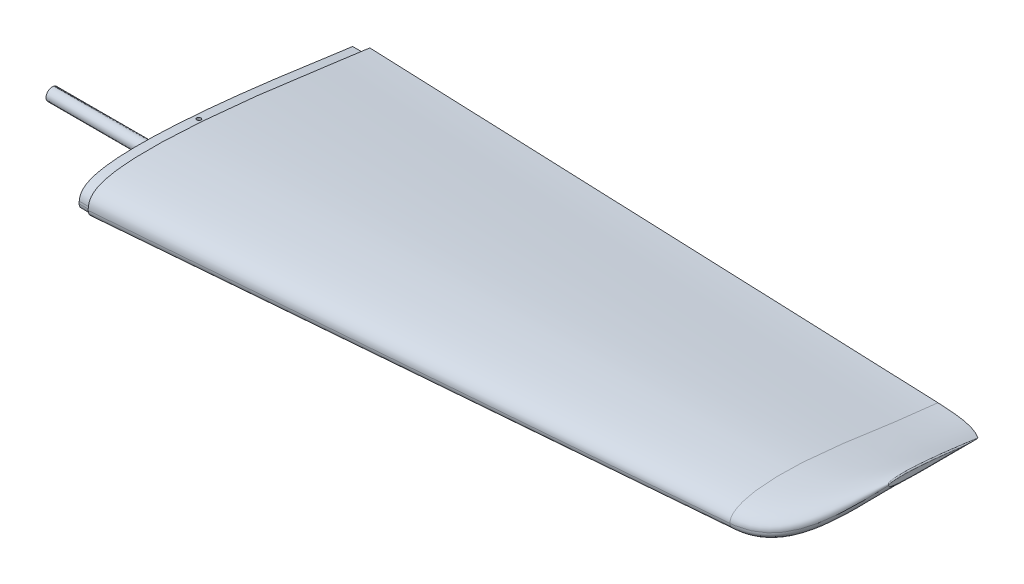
SolidWorks part; units mm, degrees
ref_plane "Front Plane" through (0, 0, 0) normal (0, 0, 1) x (1, 0, 0)
ref_plane "Top Plane" through (0, 0, 0) normal (0, 1, 0) x (1, 0, 0)
ref_plane "Right Plane" through (0, 0, 0) normal (1, 0, 0) x (0, 0, -1)
sketch "Sketch1" plane through (0, 0, 0) normal (1, 0, 0) x (0, 0, -1)
  spline S0 degree 5 poles (2952.4377, 714.2145) (-3950.7893, -404.0185) (5403.0351, 63.7514) (-5791.8485, 254.0841) (4132.9966, -89.5548) (-3213.7891, -212.6999) knots -1.284262 -1.284262 -1.284262 -1.284262 -1.284262 -1.284262 2.101509 2.101509 2.101509 2.101509 2.101509 2.101509 only from (41.3116, 20) to (-230.462, 22.2132) construction
  spline S2 degree 5 poles (41.3116, 20) (-5.4057, 25.19) (-86.087, 40.9859) (-202.7415, 49.6835) (-228.6633, 43.27) (-230.462, 22.2132) knots 0 0 0 0 0 0 0.979969 0.979969 0.979969 0.979969 0.979969 0.979969
  spline S3 degree 5 poles (-3149.1163, 653.2935) (4472.5292, -309.3143) (-6676.5573, 85.3178) (6680.972, 70.2042) (-4911.318, -187.2823) (2983.3997, 534.4321) knots -1.198996 -1.198996 -1.198996 -1.198996 -1.198996 -1.198996 2.46145 2.46145 2.46145 2.46145 2.46145 2.46145 only from (-230.5509, 20) to (41.3116, 20) construction
  spline S4 degree 5 poles (2696.3783, 672.1362) (-3670.2914, -389.7404) (5148.682, 68.0628) (-5640.6553, 248.8183) (4077.0527, -90.5219) (-3214.3233, -212.7089) knots -1.258218 -1.258218 -1.258218 -1.258218 -1.258218 -1.258218 2.101558 2.101558 2.101558 2.101558 2.101558 2.101558 only from (-230.462, 22.2132) to (-230.5509, 20) construction
  spline S5 degree 5 poles (-230.5509, 20) (-230.5509, 3.5988) (-195.743, 3.0631) (-74.1311, 6.2775) (10.2472, 10.2955) (41.3116, 20) knots 0 0 0 0 0 0 1 1 1 1 1 1
  spline S6 degree 5 poles (-230.462, 22.2132) (-230.4988, 21.7828) (-230.5255, 21.3462) (-230.5426, 20.9036) (-230.5509, 20.4549) (-230.5509, 20) knots 0.979969 0.979969 0.979969 0.979969 0.979969 0.979969 1 1 1 1 1 1
ref_plane "Plane1" through (570, 0, 0) normal (1, 0, 0) x (0, 0, -1)
sketch "Sketch2" plane through (570, 0, 0) normal (1, 0, 0) x (0, 0, -1)
  line L0 (-181.1092, 18.7085) -> (-181.1092, 38.9448) construction
  line L1 (-181.1092, 38.9448) -> (-123.2805, 43.5905) construction
  line L2 (-123.2805, 43.5905) -> (-54.3198, 27.7563) construction
  line L3 (-54.3198, 27.7563) -> (-15.1798, 21.927) construction
  line L4 (-15.1798, 21.927) -> (19.7964, 19.0955) construction
  line L5 (-181.1092, 18.7085) -> (-181.1092, -2.2997) construction
  line L6 (-181.1092, -2.2997) -> (-109.1149, 13.356) construction
  line L7 (-109.1149, 13.356) -> (-44.4931, 11.9338) construction
  line L8 (-44.4931, 11.9338) -> (-14.1805, 14.4321) construction
  line L9 (-14.1805, 14.4321) -> (19.7964, 19.0955) construction
  spline_without_curve S0
  spline_without_curve S1
  dimension "D1" = 19.7964
  dimension "D2" = 14.1805
  dimension "D3" = 15.1798
  dimension "D4" = 44.4931
  dimension "D5" = 54.3198
  dimension "D6" = 109.1149
  dimension "D7" = 123.2805
  dimension "D8" = 181.1092
  dimension "D9" = 11.9338
  dimension "D10" = 13.356
  dimension "D11" = 14.4321
  dimension "D12" = 18.7085
  dimension "D13" = 19.0955
  dimension "D14" = 21.927
  dimension "D15" = 27.7563
  dimension "D16" = 38.9448
  dimension "D17" = 43.5905
  dimension "D18" = 2.2997
loft "Loft1" add profiles "Sketch1", "Sketch2"
sketch "Sketch3" plane through (570, 0, 0) normal (1, 0, 0) x (0, 0, -1)
  spline S2 degree 5 poles (1358.2702, 1294.7476) (-1454.972, -1242.9893) (176.522, 1147.2012) (676.699, -975.6765) (-1197.9925, 836.9635) (1926.9197, -556.4867) knots -0.951211 -0.951211 -0.951211 -0.951211 -0.951211 -0.951211 2.263642 2.263642 2.263642 2.263642 2.263642 2.263642 only from (-181.1092, 18.7085) to (19.7964, 19.0955)
  spline S3 degree 5 poles (-181.1092, 18.7085) (-181.1092, -2.2997) (-109.1149, 13.356) (-44.4931, 11.9338) (-14.1805, 14.4321) (19.7964, 19.0955) knots 0 0 0 0 0 0 1 1 1 1 1 1
  spline S4 degree 5 poles (1817.3748, -850.8395) (-1728.2101, 1182.0414) (1798.3394, -1432.1315) (-1265.8092, 1574.5215) (-647.0871, -1188.1411) (1701.7582, 523.8863) knots -1.280148 -1.280148 -1.280148 -1.280148 -1.280148 -1.280148 2.307232 2.307232 2.307232 2.307232 2.307232 2.307232 only from (19.7964, 19.0955) to (-181.1092, 18.7085)
  spline S5 degree 5 poles (19.7964, 19.0955) (-15.1798, 21.927) (-54.3198, 27.7563) (-123.2805, 43.5905) (-181.1092, 38.9448) (-181.1092, 18.7085) knots 0 0 0 0 0 0 1 1 1 1 1 1
  dimension "D1" = 0
ref_plane "Plane2" through (634, 0, 0) normal (1, 0, 0) x (0, 0, -1)
sketch "Sketch4" plane through (634, 0, 0) normal (1, 0, 0) x (0, 0, -1)
  line L0 (-92.0168, 37.6148) -> (-92.0168, 42.6148) construction
  line L1 (-92.0168, 42.6148) -> (-57.0806, 41.5276) construction
  line L2 (-57.0806, 41.5276) -> (-5.2819, 33.7019) construction
  line L3 (-92.0168, 37.6148) -> (-92.0168, 32.6148) construction
  line L4 (-92.0168, 32.6148) -> (-57.267, 34.0746) construction
  line L5 (-57.267, 34.0746) -> (-5.2819, 33.7019) construction
  spline S0 degree 3 poles (-92.0168, 37.6148) (-92.0168, 42.6148) (-57.0806, 41.5276) (-5.2819, 33.7019) knots 0 0 0 0 1 1 1 1
  spline S1 degree 3 poles (-92.0168, 37.6148) (-92.0168, 32.6148) (-57.267, 34.0746) (-5.2819, 33.7019) knots 0 0 0 0 1 1 1 1
  dimension "D1" = 5
  dimension "D2" = 5.2819
  dimension "D3" = 57.0806
  dimension "D4" = 57.267
  dimension "D5" = 92.0168
  dimension "D6" = 32.6148
  dimension "D7" = 33.7019
  dimension "D8" = 34.0746
  dimension "D10" = 41.5276
loft "Loft2" add profiles "Sketch3", "Sketch4"
sketch "Sketch5" plane through (0, 0, 0) normal (-1, 0, 0) x (0, 0, 1)
  line L0 (113.4285, 11.4777) -> (113.4285, 7.8638) construction
  line L1 (123.9285, 11.4777) -> (113.4285, 11.4777) construction
  line L2 (123.9285, 7.6059) -> (123.9285, 11.4777) construction
  line L3 (113.4285, 11.4777) -> (113.4285, 7.8638)
  line L4 (123.9285, 11.4777) -> (113.4285, 11.4777)
  line L5 (123.9285, 7.6059) -> (123.9285, 11.4777)
  spline S2 degree 3 poles (-98.0213, 3009.8518) (-234.8212, 134.1255) (-133.9669, 36.7131) (-23.6242, 17.3831) (-20.8516, 16.9523) (-15.3007, 16.1593) (-12.5223, 15.7977) (-6.9612, 15.1235) (-4.1785, 14.8112) (4.1742, 13.9295) (9.7489, 13.4148) (20.9063, 12.478) (26.489, 12.0567) (43.2458, 10.8941) (54.4284, 10.2517) (76.8086, 9.1439) (88.0077, 8.68) (110.4146, 7.9195) (121.6195, 7.6223) (138.4299, 7.3398) (144.0338, 7.2733) (155.2431, 7.2134) (160.849, 7.2195) (172.0593, 7.3383) (177.6634, 7.4496) (186.067, 7.7504) (188.8672, 7.8734) (194.4638, 8.1832) (197.2607, 8.3697) (202.8472, 8.8399) (205.6354, 9.1222) (209.8045, 9.6697) (211.1918, 9.8732) (213.955, 10.3394) (215.3321, 10.6019) (218.0679, 11.2167) (219.4235, 11.5672) (221.4251, 12.2059) (222.0885, 12.4387) (223.3906, 12.9552) (224.0289, 13.2384) (225.2674, 13.8788) (225.8682, 14.2352) (227.0069, 15.0704) (227.531, 15.5393) (228.1987, 16.3618) (228.3988, 16.6543) (228.7373, 17.2634) (228.8775, 17.5822) (229.0982, 18.249) (229.178, 18.5974) (233.5383, 48.7828) (32.2779, 103.3898) (3215.602, -249.8222) knots -1.183286 -1.183286 -1.183286 -1.183286 0.03125 0.03125 0.0625 0.0625 0.09375 0.09375 0.125 0.125 0.1875 0.1875 0.25 0.25 0.375 0.375 0.5 0.5 0.625 0.625 0.6875 0.6875 0.75 0.75 0.8125 0.8125 0.84375 0.84375 0.875 0.875 0.90625 0.90625 0.921875 0.921875 0.9375 0.9375 0.953125 0.953125 0.960938 0.960938 0.96875 0.96875 0.976562 0.976562 0.984375 0.984375 0.988281 0.988281 0.992188 0.992188 0.996094 0.996094 1.330737 1.330737 1.330737 1.330737 only from (-34.6785, 19.5247) to (229.3009, 20)
  spline S3 degree 3 poles (-34.6785, 19.5247) (-31.9234, 18.8898) (-29.16, 18.3529) (-23.6242, 17.3831) (-20.8516, 16.9523) (-15.3007, 16.1593) (-12.5223, 15.7977) (-6.9612, 15.1235) (-4.1785, 14.8112) (4.1742, 13.9295) (9.7489, 13.4148) (20.9063, 12.478) (26.489, 12.0567) (43.2458, 10.8941) (54.4284, 10.2517) (76.8086, 9.1439) (88.0077, 8.68) (110.4146, 7.9195) (121.6195, 7.6223) (138.4299, 7.3398) (144.0338, 7.2733) (155.2431, 7.2134) (160.849, 7.2195) (172.0593, 7.3383) (177.6634, 7.4496) (186.067, 7.7504) (188.8672, 7.8734) (194.4638, 8.1832) (197.2607, 8.3697) (202.8472, 8.8399) (205.6354, 9.1222) (209.8045, 9.6697) (211.1918, 9.8732) (213.955, 10.3394) (215.3321, 10.6019) (218.0679, 11.2167) (219.4235, 11.5672) (221.4251, 12.2059) (222.0885, 12.4387) (223.3906, 12.9552) (224.0289, 13.2384) (225.2674, 13.8788) (225.8682, 14.2352) (227.0069, 15.0704) (227.531, 15.5393) (228.1987, 16.3618) (228.3988, 16.6543) (228.7373, 17.2634) (228.8775, 17.5822) (229.0982, 18.249) (229.178, 18.5974) (229.2786, 19.294) (229.3009, 19.6457) (229.3009, 20) knots 0 0 0 0 0.03125 0.03125 0.0625 0.0625 0.09375 0.09375 0.125 0.125 0.1875 0.1875 0.25 0.25 0.375 0.375 0.5 0.5 0.625 0.625 0.6875 0.6875 0.75 0.75 0.8125 0.8125 0.84375 0.84375 0.875 0.875 0.90625 0.90625 0.921875 0.921875 0.9375 0.9375 0.953125 0.953125 0.960938 0.960938 0.96875 0.96875 0.976562 0.976562 0.984375 0.984375 0.988281 0.988281 0.992188 0.992188 0.996094 0.996094 1 1 1 1
  spline S4 degree 3 poles (3156.1783, 672.5534) (-2720.9418, -772.2381) (3187.5295, 754.4568) (-2723.4332, -495.7356) knots -67.068437 -67.068437 -67.068437 -67.068437 62.712782 62.712782 62.712782 62.712782 only from (229.3009, 20) to (229.2165, 22.1068)
  spline S5 degree 3 poles (229.3009, 20) (229.3009, 20.7031) (229.2764, 21.4062) (229.2165, 22.1068) knots 0 0 0 0 1 1 1 1
  spline S7 degree 3 poles (3177.0592, 564.5344) (-12.755, -128.0518) (245.6017, -18.8185) (228.1741, 26.6537) (228.0284, 26.9888) (227.7108, 27.6364) (227.5382, 27.9507) (226.9799, 28.866) (226.5536, 29.4391) (225.8387, 30.2472) (225.587, 30.5089) (225.0642, 31.0119) (224.7948, 31.2518) (223.9653, 31.9412) (223.3844, 32.3606) (222.179, 33.137) (221.5546, 33.4939) (220.2711, 34.1579) (219.6178, 34.4619) (217.6422, 35.3046) (216.299, 35.7779) (213.5795, 36.6112) (212.2029, 36.9705) (209.4258, 37.6082) (208.0253, 37.8864) (205.2064, 38.3818) (203.7925, 38.5981) (199.5545, 39.173) (196.7276, 39.4602) (191.0714, 39.9116) (188.2422, 40.0749) (179.7524, 40.4322) (174.0894, 40.4963) (162.7597, 40.4182) (157.093, 40.2733) (145.7571, 39.8385) (140.0859, 39.5475) (123.084, 38.5099) (111.7698, 37.602) (89.1685, 35.5019) (77.8815, 34.307) (55.3281, 31.702) (44.0612, 30.2902) (27.1785, 28.0564) (21.5536, 27.2924) (10.3074, 25.7373) (4.6861, 24.9459) (-6.5553, 23.3558) (-12.1755, 22.5564) (-227.773, -7.4444) (-440.5038, -16.3117) (-1037.0862, 2809.5382) knots -0.505582 -0.505582 -0.505582 -0.505582 0.015625 0.015625 0.019531 0.019531 0.023437 0.023437 0.03125 0.03125 0.035156 0.035156 0.039062 0.039062 0.046875 0.046875 0.054687 0.054687 0.0625 0.0625 0.078125 0.078125 0.09375 0.09375 0.109375 0.109375 0.125 0.125 0.15625 0.15625 0.1875 0.1875 0.25 0.25 0.3125 0.3125 0.375 0.375 0.5 0.5 0.625 0.625 0.75 0.75 0.8125 0.8125 0.875 0.875 0.9375 0.9375 3.271617 3.271617 3.271617 3.271617 only from (229.2165, 22.1068) to (-34.6785, 19.5247)
  spline S8 degree 3 poles (229.2165, 22.1068) (229.0931, 23.5517) (228.8223, 24.9624) (228.1741, 26.6537) (228.0284, 26.9888) (227.7108, 27.6364) (227.5382, 27.9507) (226.9799, 28.866) (226.5536, 29.4391) (225.8387, 30.2472) (225.587, 30.5089) (225.0642, 31.0119) (224.7948, 31.2518) (223.9653, 31.9412) (223.3844, 32.3606) (222.179, 33.137) (221.5546, 33.4939) (220.2711, 34.1579) (219.6178, 34.4619) (217.6422, 35.3046) (216.299, 35.7779) (213.5795, 36.6112) (212.2029, 36.9705) (209.4258, 37.6082) (208.0253, 37.8864) (205.2064, 38.3818) (203.7925, 38.5981) (199.5545, 39.173) (196.7276, 39.4602) (191.0714, 39.9116) (188.2422, 40.0749) (179.7524, 40.4322) (174.0894, 40.4963) (162.7597, 40.4182) (157.093, 40.2733) (145.7571, 39.8385) (140.0859, 39.5475) (123.084, 38.5099) (111.7698, 37.602) (89.1685, 35.5019) (77.8815, 34.307) (55.3281, 31.702) (44.0612, 30.2902) (27.1785, 28.0564) (21.5536, 27.2924) (10.3074, 25.7373) (4.6861, 24.9459) (-6.5553, 23.3558) (-12.1755, 22.5564) (-23.4203, 20.9916) (-29.0448, 20.2238) (-34.6785, 19.5247) knots 0 0 0 0 0.015625 0.015625 0.019531 0.019531 0.023437 0.023437 0.03125 0.03125 0.035156 0.035156 0.039062 0.039062 0.046875 0.046875 0.054687 0.054687 0.0625 0.0625 0.078125 0.078125 0.09375 0.09375 0.109375 0.109375 0.125 0.125 0.15625 0.15625 0.1875 0.1875 0.25 0.25 0.3125 0.3125 0.375 0.375 0.5 0.5 0.625 0.625 0.75 0.75 0.8125 0.8125 0.875 0.875 0.9375 0.9375 1 1 1 1
  dimension "D1" = 1.25
extrude "Boss-Extrude1" add sketch "Sketch5" along normal blind 10
sketch "Sketch6" plane through (0, 0, 0) normal (0, 1, 0) x (1, 0, 0)
  circle A0 centre (-5, -118.6785) radius 2 construction
  circle A1 centre (-5, -118.6785) radius 2
extrude "Cut-Extrude1" cut sketch "Sketch6" against normal through all both and the other way through all
fillet "Fillet1" radius 1 2 edges
sketch "Sketch7" plane through (-10, 0, 0) normal (-1, 0, 0) x (0, 0, 1)
  line L3 (113.4285, 7.8638) -> (113.4285, 11.4777)
  line L4 (113.4285, 11.4777) -> (123.9285, 11.4777)
  line L5 (123.9285, 11.4777) -> (123.9285, 7.6059)
  line L6 (113.4285, 7.8638) -> (113.4285, 11.4777)
  line L7 (113.4285, 11.4777) -> (123.9285, 11.4777)
  line L8 (123.9285, 11.4777) -> (123.9285, 7.6059)
  circle A0 centre (155.4725, 24.9777) radius 7 construction
  circle A1 centre (155.4725, 24.9777) radius 7
  spline S4 degree 3 poles (3156.1783, 672.5534) (-2720.9418, -772.2381) (3187.5295, 754.4568) (-2723.4332, -495.7356) knots -67.068437 -67.068437 -67.068437 -67.068437 62.712782 62.712782 62.712782 62.712782 only from (229.3009, 20) to (229.2165, 22.1068)
  spline S5 degree 3 poles (3177.0592, 564.5344) (-12.755, -128.0518) (245.6017, -18.8185) (228.1741, 26.6537) (228.0284, 26.9888) (227.7108, 27.6364) (227.5382, 27.9507) (226.9799, 28.866) (226.5536, 29.4391) (225.8387, 30.2472) (225.587, 30.5089) (225.0642, 31.0119) (224.7948, 31.2518) (223.9653, 31.9412) (223.3844, 32.3606) (222.179, 33.137) (221.5546, 33.4939) (220.2711, 34.1579) (219.6178, 34.4619) (217.6422, 35.3046) (216.299, 35.7779) (213.5795, 36.6112) (212.2029, 36.9705) (209.4258, 37.6082) (208.0253, 37.8864) (205.2064, 38.3818) (203.7925, 38.5981) (199.5545, 39.173) (196.7276, 39.4602) (191.0714, 39.9116) (188.2422, 40.0749) (179.7524, 40.4322) (174.0894, 40.4963) (162.7597, 40.4182) (157.093, 40.2733) (145.7571, 39.8385) (140.0859, 39.5475) (123.084, 38.5099) (111.7698, 37.602) (89.1685, 35.5019) (77.8815, 34.307) (55.3281, 31.702) (44.0612, 30.2902) (27.1785, 28.0564) (21.5536, 27.2924) (10.3074, 25.7373) (4.6861, 24.9459) (-6.5553, 23.3558) (-12.1755, 22.5564) (-227.773, -7.4444) (-440.5038, -16.3117) (-1037.0862, 2809.5382) knots -0.505582 -0.505582 -0.505582 -0.505582 0.015625 0.015625 0.019531 0.019531 0.023437 0.023437 0.03125 0.03125 0.035156 0.035156 0.039062 0.039062 0.046875 0.046875 0.054687 0.054687 0.0625 0.0625 0.078125 0.078125 0.09375 0.09375 0.109375 0.109375 0.125 0.125 0.15625 0.15625 0.1875 0.1875 0.25 0.25 0.3125 0.3125 0.375 0.375 0.5 0.5 0.625 0.625 0.75 0.75 0.8125 0.8125 0.875 0.875 0.9375 0.9375 3.271617 3.271617 3.271617 3.271617 only from (229.2165, 22.1068) to (-34.6785, 19.5247)
  spline S6 degree 3 poles (-98.033, 3009.6053) (-234.8154, 134.1199) (-133.9638, 36.7126) (-23.6242, 17.3831) (-20.8516, 16.9523) (-15.3007, 16.1593) (-12.5223, 15.7977) (-6.9612, 15.1235) (-4.1785, 14.8112) (4.1742, 13.9295) (9.7489, 13.4148) (20.9063, 12.478) (26.489, 12.0567) (43.2458, 10.8941) (54.4284, 10.2517) (76.8086, 9.1439) (88.0077, 8.68) (578.7657, -7.9749) (1061.0782, 127.8245) (1582.9073, 2442.5452) knots -1.183251 -1.183251 -1.183251 -1.183251 0.03125 0.03125 0.0625 0.0625 0.09375 0.09375 0.125 0.125 0.1875 0.1875 0.25 0.25 0.375 0.375 0.5 0.5 5.850531 5.850531 5.850531 5.850531 only from (-34.6785, 19.5247) to (113.4285, 7.8638)
  spline S7 degree 3 poles (-1541.4311, -2162.4777) (-952.1126, 282.9727) (-411.9756, 16.591) (138.4299, 7.3398) (144.0338, 7.2733) (155.2431, 7.2134) (160.849, 7.2195) (172.0593, 7.3383) (177.6634, 7.4496) (186.067, 7.7504) (188.8672, 7.8734) (194.4638, 8.1832) (197.2607, 8.3698) (202.8472, 8.8399) (205.6354, 9.1222) (209.8045, 9.6697) (211.1918, 9.8732) (213.955, 10.3394) (215.3321, 10.6019) (218.0679, 11.2167) (219.4235, 11.5672) (221.4251, 12.2059) (222.0885, 12.4387) (223.3906, 12.9552) (224.0289, 13.2384) (225.2674, 13.8788) (225.8682, 14.2352) (227.0069, 15.0704) (227.531, 15.5393) (228.1987, 16.3618) (228.3988, 16.6543) (228.7373, 17.2634) (228.8775, 17.5822) (229.0982, 18.249) (229.178, 18.5974) (233.5381, 48.7817) (32.2935, 103.3856) (3215.2317, -249.7813) knots -5.451629 -5.451629 -5.451629 -5.451629 0.625 0.625 0.6875 0.6875 0.75 0.75 0.8125 0.8125 0.84375 0.84375 0.875 0.875 0.90625 0.90625 0.921875 0.921875 0.9375 0.9375 0.953125 0.953125 0.960938 0.960938 0.96875 0.96875 0.976562 0.976562 0.984375 0.984375 0.988281 0.988281 0.992188 0.992188 0.996094 0.996094 1.330724 1.330724 1.330724 1.330724 only from (123.9285, 7.6059) to (229.3009, 20)
  spline S8 degree 3 poles (229.3009, 20) (229.3009, 20.7031) (229.2764, 21.4062) (229.2165, 22.1068) knots 0 0 0 0 1 1 1 1
  spline S9 degree 3 poles (229.2165, 22.1068) (229.0931, 23.5517) (228.8223, 24.9624) (228.1741, 26.6537) (228.0284, 26.9888) (227.7108, 27.6364) (227.5382, 27.9507) (226.9799, 28.866) (226.5536, 29.4391) (225.8387, 30.2472) (225.587, 30.5089) (225.0642, 31.0119) (224.7948, 31.2518) (223.9653, 31.9412) (223.3844, 32.3606) (222.179, 33.137) (221.5546, 33.4939) (220.2711, 34.1579) (219.6178, 34.4619) (217.6422, 35.3046) (216.299, 35.7779) (213.5795, 36.6112) (212.2029, 36.9705) (209.4258, 37.6082) (208.0253, 37.8864) (205.2064, 38.3818) (203.7925, 38.5981) (199.5545, 39.173) (196.7276, 39.4602) (191.0714, 39.9116) (188.2422, 40.0749) (179.7524, 40.4322) (174.0894, 40.4963) (162.7597, 40.4182) (157.093, 40.2733) (145.7571, 39.8385) (140.0859, 39.5475) (123.084, 38.5099) (111.7698, 37.602) (89.1685, 35.5019) (77.8815, 34.307) (55.3281, 31.702) (44.0612, 30.2902) (27.1785, 28.0564) (21.5536, 27.2924) (10.3074, 25.7373) (4.6861, 24.9459) (-6.5553, 23.3558) (-12.1755, 22.5564) (-23.4203, 20.9916) (-29.0448, 20.2238) (-34.6785, 19.5247) knots 0 0 0 0 0.015625 0.015625 0.019531 0.019531 0.023437 0.023437 0.03125 0.03125 0.035156 0.035156 0.039062 0.039062 0.046875 0.046875 0.054687 0.054687 0.0625 0.0625 0.078125 0.078125 0.09375 0.09375 0.109375 0.109375 0.125 0.125 0.15625 0.15625 0.1875 0.1875 0.25 0.25 0.3125 0.3125 0.375 0.375 0.5 0.5 0.625 0.625 0.75 0.75 0.8125 0.8125 0.875 0.875 0.9375 0.9375 1 1 1 1
  spline S10 degree 3 poles (-34.6785, 19.5247) (-31.9234, 18.8898) (-29.16, 18.3529) (-23.6242, 17.3831) (-20.8516, 16.9523) (-15.3007, 16.1593) (-12.5223, 15.7977) (-6.9612, 15.1235) (-4.1785, 14.8112) (4.1742, 13.9295) (9.7489, 13.4148) (20.9063, 12.478) (26.489, 12.0567) (43.2458, 10.8941) (54.4284, 10.2517) (76.8086, 9.1439) (88.0077, 8.68) (103.95, 8.1389) (108.6891, 7.9929) (113.4285, 7.8638) knots 0 0 0 0 0.03125 0.03125 0.0625 0.0625 0.09375 0.09375 0.125 0.125 0.1875 0.1875 0.25 0.25 0.375 0.375 0.5 0.5 0.552873 0.552873 0.552873 0.552873
  spline S11 degree 3 poles (123.9285, 7.6059) (126.8943, 7.5413) (129.8603, 7.4838) (138.4299, 7.3398) (144.0338, 7.2733) (155.2431, 7.2134) (160.849, 7.2195) (172.0593, 7.3383) (177.6634, 7.4496) (186.067, 7.7504) (188.8672, 7.8734) (194.4638, 8.1832) (197.2607, 8.3698) (202.8472, 8.8399) (205.6354, 9.1222) (209.8045, 9.6697) (211.1918, 9.8732) (213.955, 10.3394) (215.3321, 10.6019) (218.0679, 11.2167) (219.4235, 11.5672) (221.4251, 12.2059) (222.0885, 12.4387) (223.3906, 12.9552) (224.0289, 13.2384) (225.2674, 13.8788) (225.8682, 14.2352) (227.0069, 15.0704) (227.531, 15.5393) (228.1987, 16.3618) (228.3988, 16.6543) (228.7373, 17.2634) (228.8775, 17.5822) (229.0982, 18.249) (229.178, 18.5974) (229.2786, 19.294) (229.3009, 19.6457) (229.3009, 20) knots 0.591916 0.591916 0.591916 0.591916 0.625 0.625 0.6875 0.6875 0.75 0.75 0.8125 0.8125 0.84375 0.84375 0.875 0.875 0.90625 0.90625 0.921875 0.921875 0.9375 0.9375 0.953125 0.953125 0.960938 0.960938 0.96875 0.96875 0.976562 0.976562 0.984375 0.984375 0.988281 0.988281 0.992188 0.992188 0.996094 0.996094 1 1 1 1
  dimension "D1" = 0
extrude "Cut-Extrude2" cut sketch "Sketch7" against normal blind 85.2 contours A1
sketch "Sketch8" plane through (75.2, 0, 0) normal (-1, 0, 0) x (0, 0, 1)
  circle A0 centre (155.4725, 24.9777) radius 6
  dimension "D1" = 12
extrude "Boss-Extrude2" add sketch "Sketch8" along normal blind 185
fillet "Fillet2" radius 0.25 3 edges
